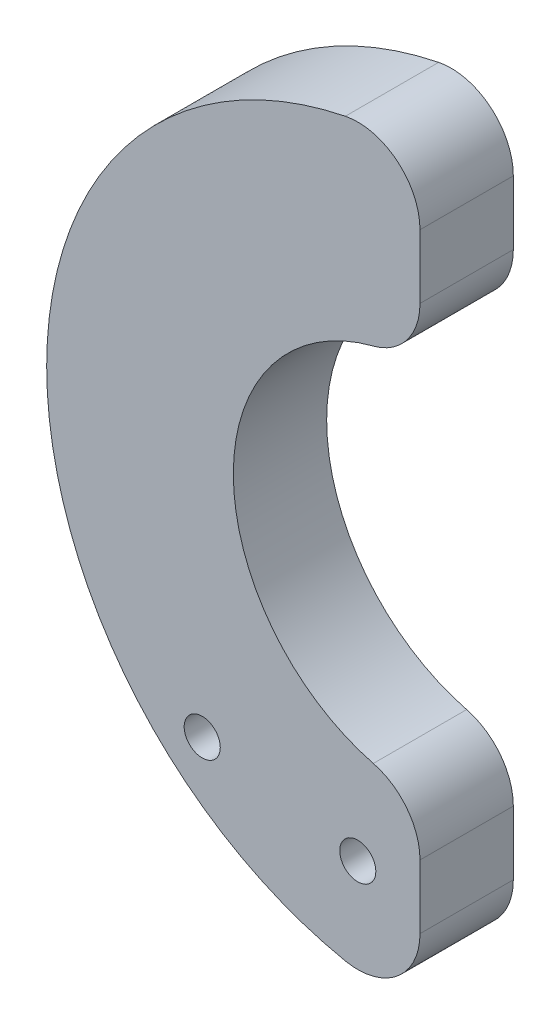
SolidWorks part; units mm, degrees
ref_plane "Front Plane" through (0, 0, 0) normal (0, 0, 1) x (1, 0, 0)
ref_plane "Top Plane" through (0, 0, 0) normal (0, 1, 0) x (1, 0, 0)
ref_plane "Right Plane" through (0, 0, 0) normal (1, 0, 0) x (0, 0, -1)
sketch "Finger Drawing" plane through (0, 0, 0) normal (0, 0, 1) x (1, 0, 0)
  line L2 (0, 15.5543) -> (0, 12.2967)
  line L3 (0, -12.2967) -> (0, -15.5543)
  arc A4 (-3.81, -18.6651) -> (-3.81, 18.6651) centre (0, 0) cw
  arc A5 (-2.3812, 9.2225) -> (-2.3812, -9.2225) centre (0, 0) ccw
  arc A6 (0, -15.5543) -> (-3.81, -18.6651) centre (-3.175, -15.5543) cw
  arc A7 (0, -12.2967) -> (-2.3812, -9.2225) centre (-3.175, -12.2967) ccw
  arc A8 (0, 15.5543) -> (-3.81, 18.6651) centre (-3.175, 15.5543) ccw
  arc A9 (0, 12.2967) -> (-2.3812, 9.2225) centre (-3.175, 12.2967) cw
  circle A10 centre (-3.175, -14.1944) radius 0.9208
  point P19 (0, 9.525)
  dimension "D1" = 9.525
  dimension "D2" = 19.05
  dimension "D3" = 3.175
  dimension "D4" = 1.8415
  dimension "D5" = 3.175
extrude "Finger Body" add sketch "Finger Drawing" along normal blind 4.7625 contours A5 A7 L3 A6 A4 A8 L2 A9
sketch "Sketch5" plane through (0, 0, 4.7625) normal (0, 0, 1) x (1, 0, 0)
  line L0 (0, -12.2967) -> (0, -15.5543) construction
  circle A0 centre (-3.175, -13.9303) radius 0.9208
  circle A2 centre (0, 0) radius 14.2875 construction
  circle A3 centre (0, 0) radius 16.6687 construction
  circle A4 centre (-11.1125, -12.4242) radius 0.9208
  point P10 (-10.7072, -12.7751)
  dimension "D1" = 1.8415
  dimension "D3" = 28.575
  dimension "D4" = 33.3375
  dimension "D6" = 1.8415
  dimension "D2" = 3.175
  dimension "D5" = 11.1125
extrude "Finger Pin Holes" cut sketch "Sketch5" against normal through all contours A0 | A4
